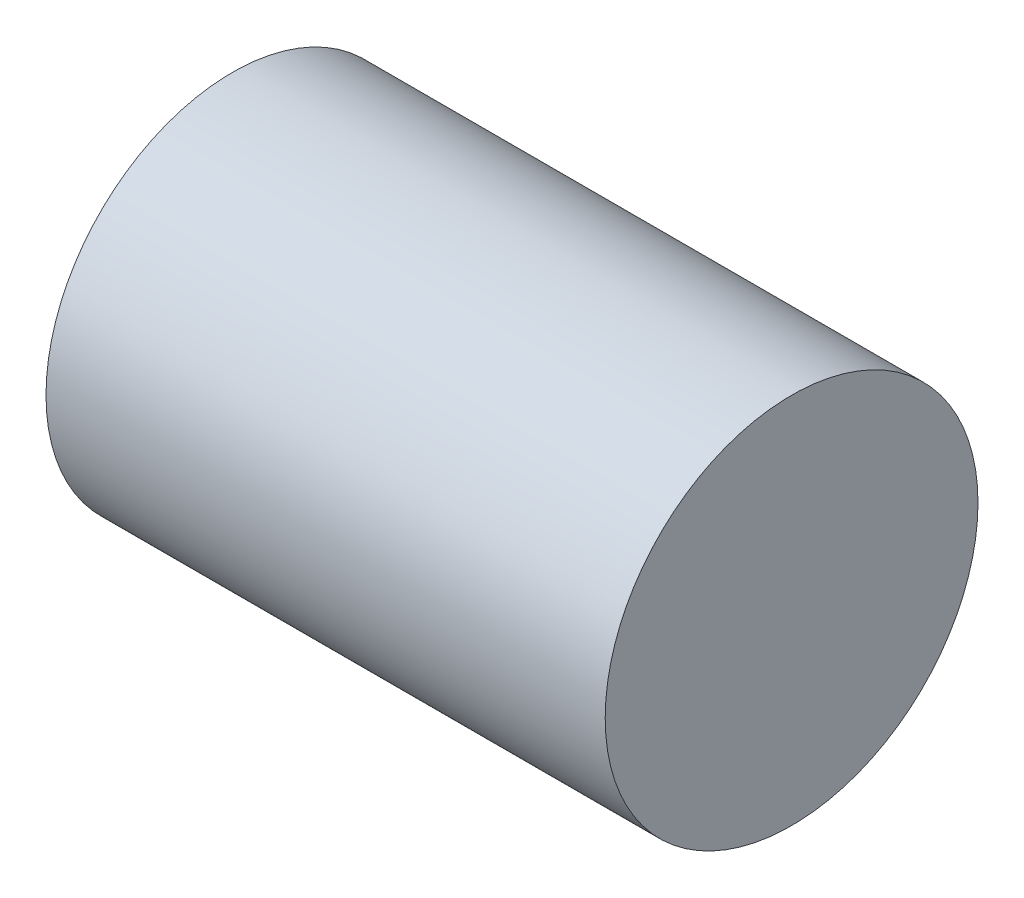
SolidWorks part; units mm, degrees
ref_plane "Front Plane" through (0, 0, 0) normal (0, 0, 1) x (1, 0, 0)
ref_plane "Top Plane" through (0, 0, 0) normal (0, 1, 0) x (1, 0, 0)
ref_plane "Right Plane" through (0, 0, 0) normal (1, 0, 0) x (0, 0, -1)
sketch "Sketch1" plane through (0, 0, 0) normal (1, 0, 0) x (0, 0, -1)
  circle A0 centre (0, 0) radius 5
  dimension "D1" = 10
extrude "Boss-Extrude1" add sketch "Sketch1" along normal blind 15
